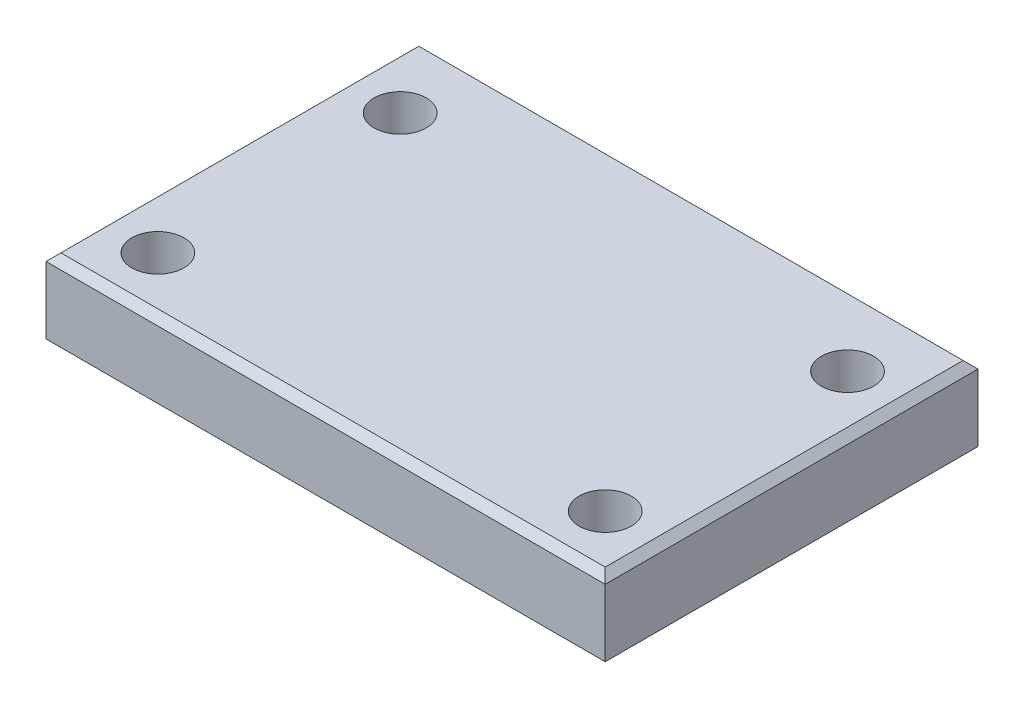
SolidWorks part; units mm, degrees
ref_plane "Front" through (0, 0, 0) normal (0, 0, 1) x (1, 0, 0)
ref_plane "Top" through (0, 0, 0) normal (0, 1, 0) x (1, 0, 0)
ref_plane "Right" through (0, 0, 0) normal (1, 0, 0) x (0, 0, -1)
sketch "Sketch1" plane through (0, 0, 0) normal (0, 1, 0) x (1, 0, 0)
  line L0 (75, -50) -> (-75, 50) construction
  line L1 (-75, 50) -> (75, 50)
  line L2 (-75, 50) -> (-75, -50)
  line L3 (-75, -50) -> (75, -50)
  line L4 (75, 50) -> (75, -50)
  dimension "D1" = 150
  dimension "D2" = 100
extrude "Extrude1" add sketch "Sketch1" along normal blind 20
chamfer "Chamfer1" distance 2 angle 45 4 edges at (-75, 20, 0) (0, 20, -50) (75, 20, 0) (0, 20, 50)
hole_wizard "M16x2.0 Tapped Hole1" positions "Sketch8" profile "Sketch7" tap size "M16x2.0" standard "Ansi Metric"
sketch "Sketch8" plane through (0, 20, 0) normal (0, 1, 0) x (-1, 0, 0)
  line L0 (75, 50) -> (75, -50) construction
  line L1 (-75, 50) -> (75, 50) construction
  point P0 (60, 35)
  dimension "D1" = 15
  dimension "D2" = 15
sketch "Sketch7" plane through (-60, 20, 35) normal (1, 0, 0) x (0, 0, 1)
  line L0 (0, 0) -> (0, 20)
  line L1 (0, 20) -> (7, 20)
  line L2 (7, 20) -> (7, 0)
  line L5 (7, 0) -> (0, 0)
  line L11 (0, -6.35) -> (0, 107.95) construction
  dimension "Thru Tap Drill Dia." = 14
  dimension "Thru Tap Drill Depth" = 20
pattern_linear "LPattern3" count 2 spacing 65 along (0, 0, -1) count 2 spacing 120 along (1, 0, 0) of "M16x2.0 Tapped Hole1"
